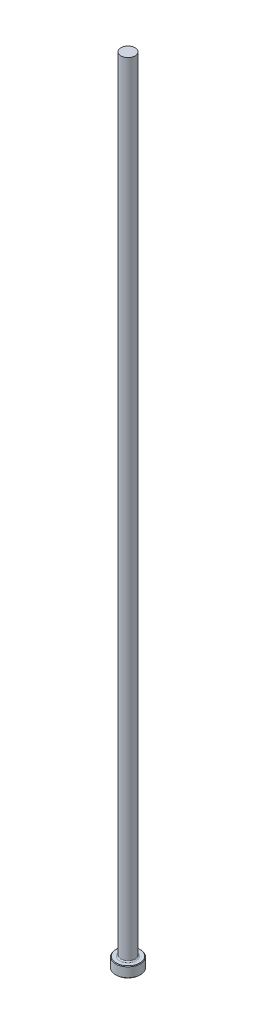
SolidWorks part; units mm, degrees
ref_plane "Front Plane" through (0, 0, 0) normal (0, 0, 1) x (1, 0, 0)
ref_plane "Top Plane" through (0, 0, 0) normal (0, 1, 0) x (1, 0, 0)
ref_plane "Right Plane" through (0, 0, 0) normal (1, 0, 0) x (0, 0, -1)
sketch "Sketch1" plane through (0, 0, 0) normal (0, 0, 1) x (1, 0, 0)
  line L0 (0, 259.9588) -> (0, -15.1925) construction
  line L1 (0, 0) -> (-5.5499, 0)
  line L2 (-5.5499, 0) -> (-5.5499, 4.7498)
  line L3 (-5.5499, 4.7498) -> (-3.175, 4.7498)
  line L4 (-3.175, 4.7498) -> (-3.175, 355.6)
  line L5 (-3.175, 355.6) -> (0, 355.6)
  line L6 (0, 355.6) -> (0, 0)
  dimension "L" = 355.6
  dimension "H" = 11.0998
  dimension "T" = 4.7498
  dimension "D" = 6.35
revolve "Revolve1" add sketch "Sketch1" angle 360 about L0
chamfer "Chamfer1" distance 0.254 angle 45 2 edges at (0, 4.7498, 5.5499) (0, 0, 5.5499)
fillet "Fillet1" radius 0.508 1 edges at (0, 4.7498, 3.175)
sketch "Pocket Sketch" plane through (0, 0, 0) normal (0, 0, 1) x (1, 0, 0)
  line L0 (-5.9468, 0) -> (-5.9468, 4.7752)
  line L1 (-5.9468, 4.7752) -> (-4.3339, 4.7752)
  line L2 (-3.5719, 5.5372) -> (-3.5719, 22.225)
  line L3 (-3.5719, 22.225) -> (0, 22.225)
  line L4 (0, 22.225) -> (0, 0)
  line L5 (0, 0) -> (-5.9468, 0)
  line L6 (0, 12.6104) -> (0, -2.4989) construction
  line L7 (-5.5499, 4.4958) -> (-5.5499, 0.254) construction
  line L8 (5.2959, 4.7498) -> (-5.2959, 4.7498) construction
  line L9 (-3.175, 355.6) -> (-3.175, 5.2578) construction
  line L10 (-4.3339, 4.7752) -> (-3.5719, 5.5372)
  point P3 (-3.5719, 4.7752)
  dimension "D1" = 11.8935
  dimension "D2" = 0.3969
  dimension "D3" = 0.0254
  dimension "D4" = 0.3969
  dimension "D5" = 7.1437
  dimension "D6" = 22.225
